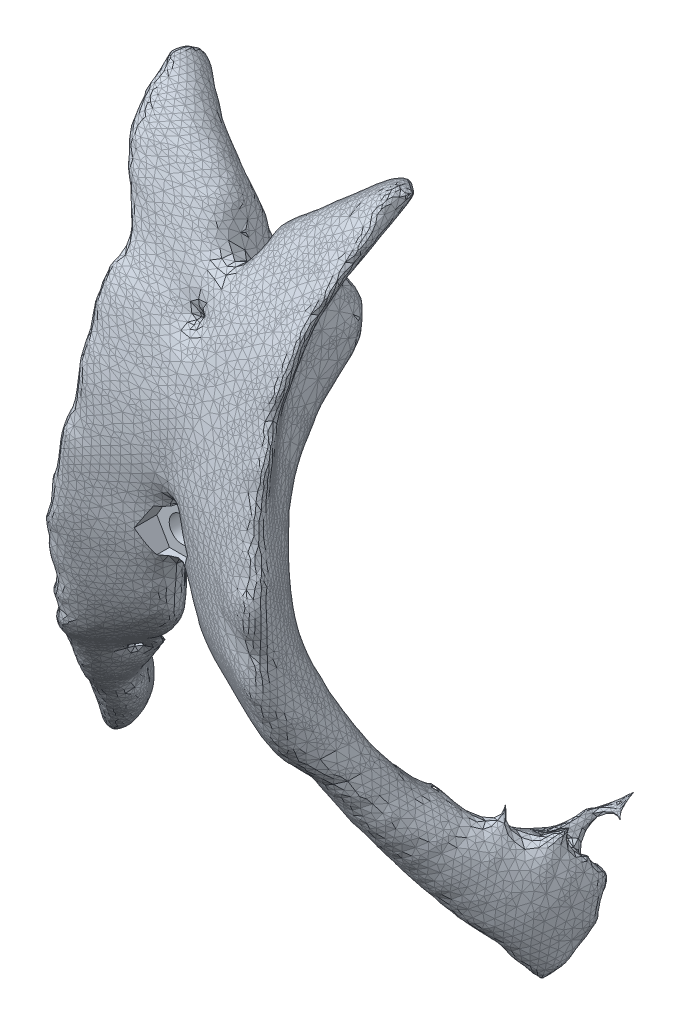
SolidWorks part; units mm, degrees
ref_plane "前视基准面" through (0, 0, 0) normal (0, 0, 1) x (1, 0, 0)
ref_plane "上视基准面" through (0, 0, 0) normal (0, 1, 0) x (1, 0, 0)
ref_plane "右视基准面" through (0, 0, 0) normal (1, 0, 0) x (0, 0, -1)
imported_body "输入1"
ref_plane "基准面5" through (0, 0, 22.8152) normal (0, 0, 1) x (1, 0, 0)
sketch "草图4" plane through (0, 0, 22.8152) normal (0, 0, 1) x (1, 0, 0)
  circle A0 centre (-2.1607, 3.1641) radius 1.7
  dimension "D1" = 3.4
sketch "草图6" plane through (0, 0, 0) normal (0, 0, 1) x (1, 0, 0)
  circle A0 centre (-2.1607, 3.1641) radius 1.7
extrude "切除-拉伸7" cut sketch "草图6" along normal through all
sketch "草图7" plane through (0, 0, 0) normal (0, 0, 1) x (1, 0, 0)
  circle A0 centre (-2.1607, 3.1641) radius 3
  dimension "D1" = 6
extrude "切除-拉伸8" cut sketch "草图7" along normal up to surface (22.8152 mm away)
ref_plane "基准面6" through (0, 0, 40) normal (0, 0, 1) x (1, 0, 0)
sketch "草图8" plane through (0, 0, 40) normal (0, 0, 1) x (1, 0, 0)
  line L0 (-6.5486, -42.9267) -> (4.2503, -42.9267) construction
  line L1 (-0.5009, 0.2891) -> (1.159, 3.1641)
  line L2 (1.159, 3.1641) -> (-0.5009, 6.0391)
  line L3 (-0.5009, 6.0391) -> (-3.8206, 6.0391)
  line L4 (-3.8206, 6.0391) -> (-5.4805, 3.1641)
  line L5 (-5.4805, 3.1641) -> (-3.8206, 0.2891)
  line L6 (-3.8206, 0.2891) -> (-0.5009, 0.2891)
  circle A0 centre (-2.1607, 3.1641) radius 2.875 construction
  dimension "D1" = 5.75
  dimension "D2" = 0
extrude "切除-拉伸9" cut sketch "草图8" against normal blind 15
